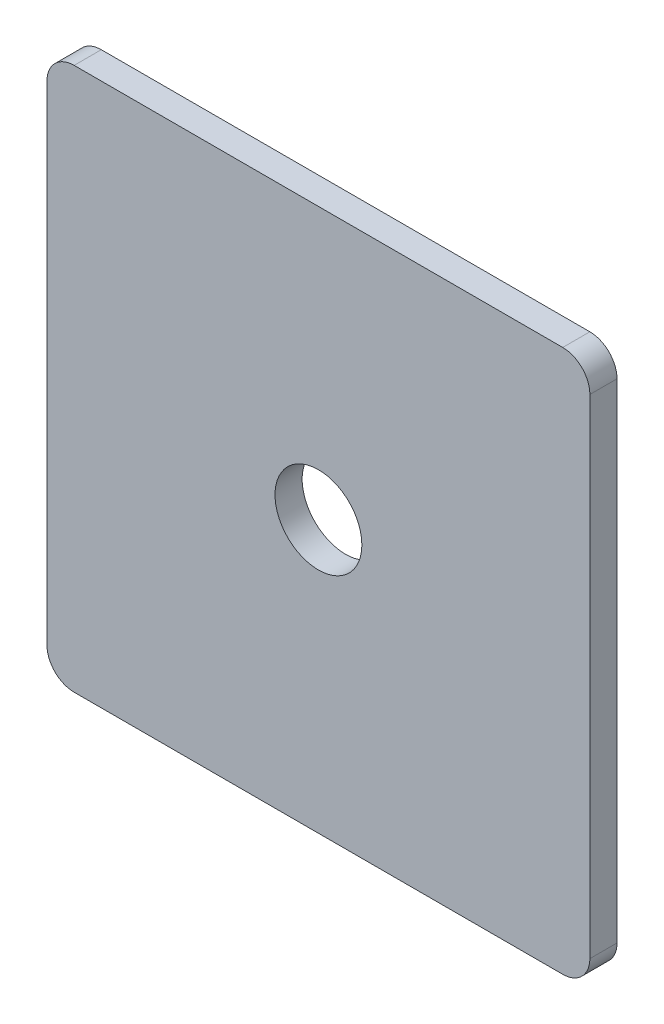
SolidWorks part; units mm, degrees
ref_plane "Plan de face" through (0, 0, 0) normal (0, 0, 1) x (1, 0, 0)
ref_plane "Plan de dessus" through (0, 0, 0) normal (0, 1, 0) x (1, 0, 0)
ref_plane "Plan de droite" through (0, 0, 0) normal (1, 0, 0) x (0, 0, -1)
sketch "Esquisse1" plane through (0, 0, 0) normal (0, 0, 1) x (1, 0, 0)
  line L1 (0, 0) -> (100, 0)
  line L2 (0, 0) -> (0, 100)
  line L3 (0, 100) -> (100, 100)
  line L4 (100, 0) -> (100, 100)
  dimension "D1" = 100
  dimension "D2" = 100
extrude "Boss.-Extru.1" add sketch "Esquisse1" along normal blind 5
sketch "Esquisse3" plane through (0, 0, 5) normal (0, 0, 1) x (1, 0, 0)
  circle A0 centre (50, 50) radius 8
extrude "Enlèv. mat.-Extru.1" cut sketch "Esquisse3" against normal blind 5
fillet "Congé1" radius 5 4 edges at (0, 0, 2.5) (0, 100, 2.5) (100, 0, 2.5) (100, 100, 2.5)
